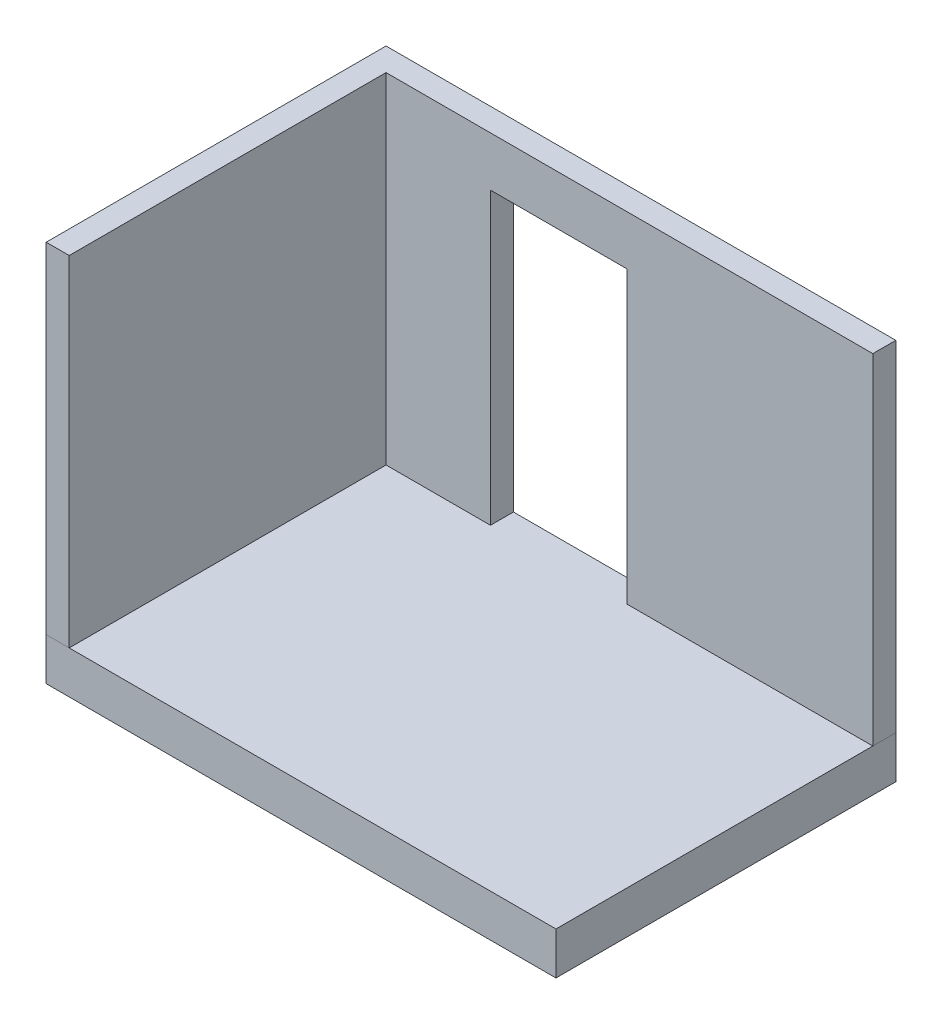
SolidWorks part; units mm, degrees
other "Floor"
other "Walls"
ref_plane "Front Plane" through (0, 0, 0) normal (0, 0, 1) x (1, 0, 0)
ref_plane "Top Plane" through (0, 0, 0) normal (0, 1, 0) x (1, 0, 0)
ref_plane "Right Plane" through (0, 0, 0) normal (1, 0, 0) x (0, 0, -1)
sketch "Sketch1" plane through (0, 0, 0) normal (0, 1, 0) x (1, 0, 0)
  line L1 (0, 0) -> (3657.6, 0)
  line L2 (0, 0) -> (0, -2438.4)
  line L3 (0, -2438.4) -> (3657.6, -2438.4)
  line L4 (3657.6, 0) -> (3657.6, -2438.4)
  dimension "D1" = 3657.6
  dimension "D2" = 2438.4
extrude "Floor" add sketch "Sketch1" against normal blind 304.8
sketch "Sketch2" plane through (0, 0, 0) normal (0, 1, 0) x (1, 0, 0)
  line L5 (3657.6, -165.1) -> (165.1, -165.1)
  line L6 (165.1, -165.1) -> (165.1, -2438.4)
  line L7 (3657.6, -165.1) -> (165.1, -165.1)
  line L8 (165.1, -165.1) -> (165.1, -2438.4)
  line L11 (0, 0) -> (0, -2438.4)
  line L12 (0, -2438.4) -> (3657.6, -2438.4)
  line L13 (3657.6, -2438.4) -> (3657.6, 0)
  line L14 (3657.6, 0) -> (0, 0)
  line L15 (0, 0) -> (0, -2438.4)
  line L16 (0, -2438.4) -> (165.1, -2438.4)
  line L17 (3657.6, -165.1) -> (3657.6, 0)
  line L18 (3657.6, 0) -> (0, 0)
  dimension "D1" = 165.1
  dimension "D2" = 0
extrude "Walls" add sketch "Sketch2" along normal blind 2438.4 separate body
sketch "Sketch3" plane through (0, 0, 0) normal (0, 0, -1) x (-1, 0, 0)
  line L0 (-3657.6, 0) -> (0, 0) construction
  line L1 (-1892.3, 0) -> (-914.4, 0)
  line L2 (-1892.3, 0) -> (-1892.3, 2082.8)
  line L3 (-1892.3, 2082.8) -> (-914.4, 2082.8)
  line L4 (-914.4, 0) -> (-914.4, 2082.8)
  line L5 (0, 2438.4) -> (0, 0) construction
  dimension "D1" = 2082.8
  dimension "D2" = 977.9
  dimension "D3" = 914.4
extrude "Rough Opening" cut sketch "Sketch3" against normal blind 2438.4
ref_plane "Right Door Plane" through (1403.35, 0, 0) normal (1, 0, 0) x (0, 0, -1)
